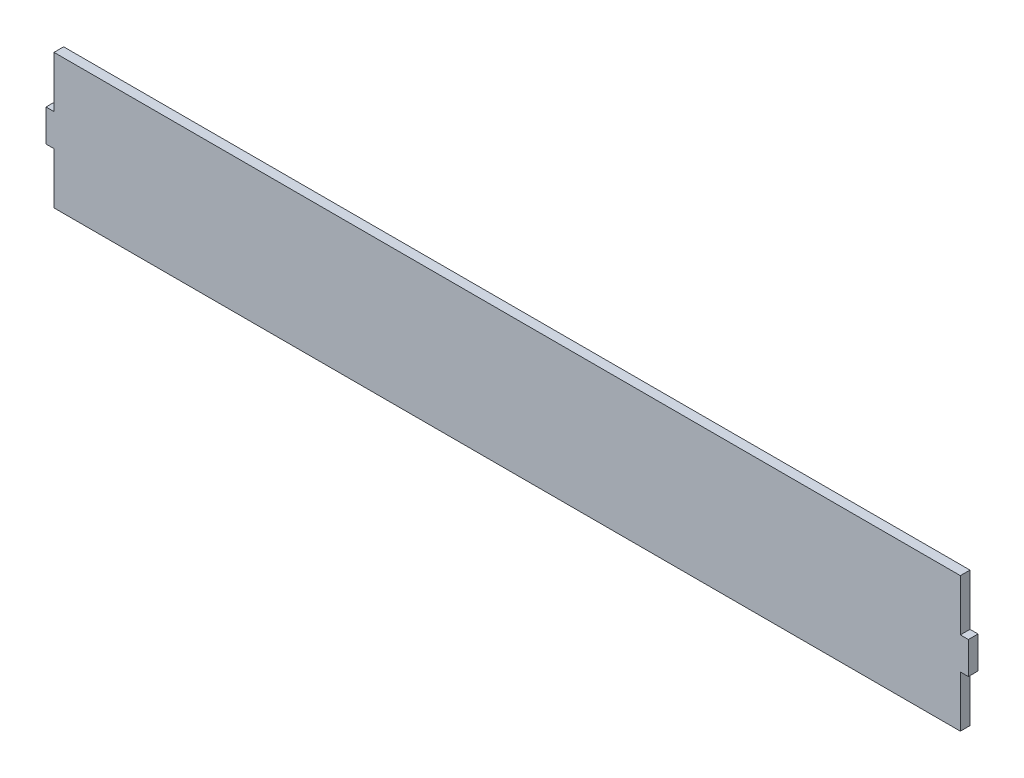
SolidWorks part; units mm, degrees
ref_plane "Front Plane" through (0, 0, 0) normal (0, 0, 1) x (1, 0, 0)
ref_plane "Top Plane" through (0, 0, 0) normal (0, 1, 0) x (1, 0, 0)
ref_plane "Right Plane" through (0, 0, 0) normal (1, 0, 0) x (0, 0, -1)
sketch "Sketch1" plane through (0, 0, 0) normal (0, 0, 1) x (1, 0, 0)
  line L0 (-110.2336, 12.7) -> (-110.2336, 33.02)
  line L1 (-110.2336, 33.02) -> (248.5414, 33.02)
  line L2 (-110.2336, 0) -> (-110.2336, -20.32)
  line L3 (-110.2336, -20.32) -> (248.5414, -20.32)
  line L4 (248.5414, 12.7) -> (248.5414, 33.02)
  line L5 (-113.4086, 12.7) -> (-110.2336, 12.7)
  line L6 (-113.4086, 12.7) -> (-113.4086, 0)
  line L7 (-113.4086, 0) -> (-110.2336, 0)
  line L9 (248.5414, 12.7) -> (251.7164, 12.7)
  line L11 (248.5414, 0) -> (251.7164, 0)
  line L12 (251.7164, 12.7) -> (251.7164, 0)
  line L13 (248.5414, 0) -> (248.5414, -20.32)
  dimension "D2" = 53.34
  dimension "D3" = 20.32
  dimension "D4" = 12.7
  dimension "D5" = 20.32
  dimension "D6" = 12.7
  dimension "D7" = 20.32
  dimension "D9" = 3.175
  dimension "D10" = 3.175
extrude "Extrude1" add sketch "Sketch1" along normal blind 3.81
